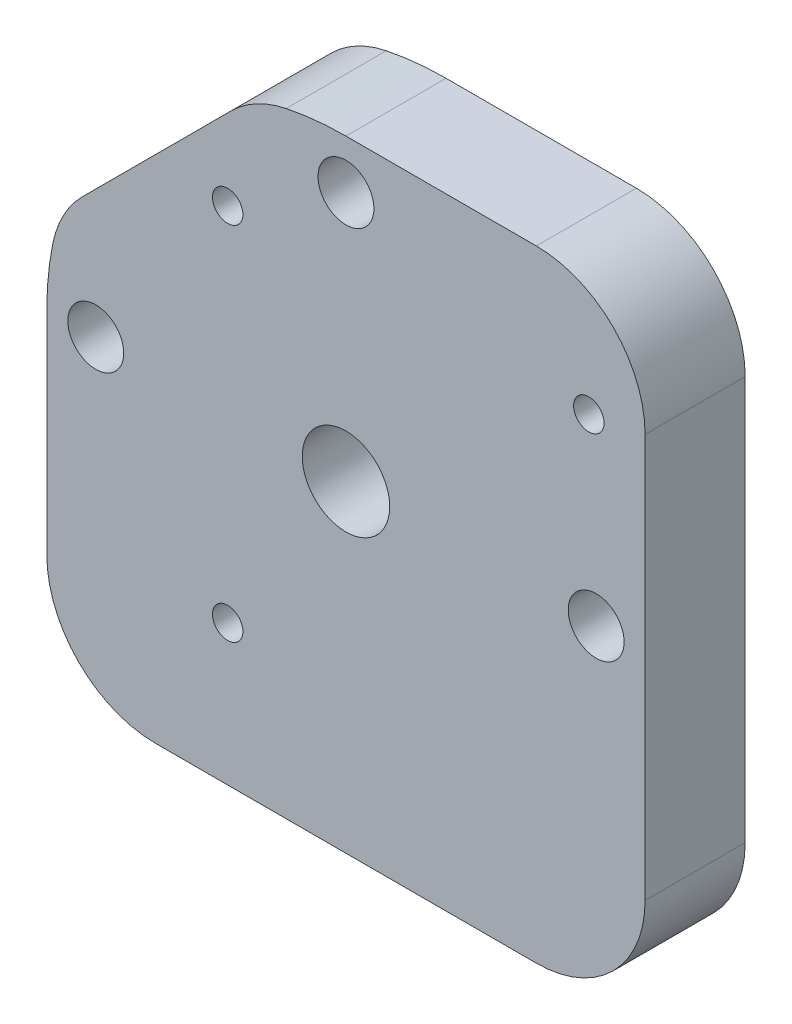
SolidWorks part; units mm, degrees
ref_plane "Front Plane" through (0, 0, 0) normal (0, 0, 1) x (1, 0, 0)
ref_plane "Top Plane" through (0, 0, 0) normal (0, 1, 0) x (1, 0, 0)
ref_plane "Right Plane" through (0, 0, 0) normal (1, 0, 0) x (0, 0, -1)
sketch "Sketch1" plane through (0, 0, 0) normal (0, 0, 1) x (1, 0, 0)
  circle A0 centre (0, 0) radius 17.4625
  dimension "D1" = 34.925
extrude "Boss-Extrude1" add sketch "Sketch1" along normal blind 5.842
sketch "Sketch6" plane through (0, 0, 5.842) normal (0, 0, 1) x (1, 0, 0)
  line L0 (-17.4625, 0) -> (0, 0)
  line L2 (-17.4625, 0) -> (-17.4625, -18.796)
  line L3 (-17.4625, -18.796) -> (17.4625, -18.796)
  line L4 (17.4625, 0) -> (17.4625, -18.796)
  line L5 (0, 0) -> (0, 17.4625)
  line L6 (0, 17.4625) -> (17.4625, 17.4625)
  line L7 (17.4625, 17.4625) -> (17.4625, 0)
  circle A0 centre (0, 0) radius 17.4625 construction
extrude "Boss-Extrude2" add sketch "Sketch6" against normal up to surface (5.842 mm away)
fillet "Fillet1" radius 6.35 3 edges at (17.4625, -18.796, 2.921) (-17.4625, -18.796, 2.921) (17.4625, 17.4625, 2.921)
hole_wizard "#4 Clearance Hole1" positions "Sketch2" profile "Sketch3" hole size "#4" standard "ANSI Inch"
sketch "Sketch2" plane through (0, 0, 5.842) normal (0, 0, 1) x (1, 0, 0)
  circle A0 centre (0, 0) radius 14.605
  point P5 (14.605, 0)
  point P7 (0, 14.605)
  point P9 (-14.605, 0)
  dimension "D1" = 29.21
sketch "Sketch3" plane through (-14.605, 0, 5.842) normal (1, 0, 0) x (0, -1, 0)
  line L0 (0, 0) -> (0, 5.842)
  line L1 (0, 5.842) -> (1.6319, 5.842)
  line L2 (1.6319, 5.842) -> (1.6319, 0)
  line L5 (1.6319, 0) -> (0, 0)
  line L11 (0, -6.35) -> (0, 107.95) construction
  dimension "Thru Hole Dia." = 3.2639
  dimension "Thru Hole Depth" = 5.842
hole_wizard "#2-56 Tapped Hole1" positions "Sketch7" profile "Sketch8" tap size "#2-56" standard "ANSI Inch"
sketch "Sketch7" plane through (0, 0, 5.842) normal (0, 0, 1) x (1, 0, 0)
  point P0 (-6.9052, 10.4822)
  point P3 (-6.9052, -10.5998)
  point P5 (14.1768, 10.4822)
sketch "Sketch8" plane through (-6.9052, 10.4822, 5.842) normal (1, 0, 0) x (0, -1, 0)
  line L0 (0, 0) -> (0, 5.842)
  line L1 (0, 5.842) -> (0.889, 5.842)
  line L2 (0.889, 5.842) -> (0.889, 0)
  line L5 (0.889, 0) -> (0, 0)
  line L11 (0, -6.35) -> (0, 107.95) construction
  dimension "Thru Tap Drill Dia." = 1.778
  dimension "Thru Tap Drill Depth" = 5.842
sketch "Sketch9" plane through (0, 0, 5.842) normal (0, 0, 1) x (1, 0, 0)
  line L0 (-19.7735, 2.315) -> (-1.6108, 20.4777)
  line L1 (-19.7735, 2.315) -> (-19.7735, 20.4777)
  line L2 (-19.7735, 20.4777) -> (-1.6108, 20.4777)
  dimension "D1" = 45
extrude "Cut-Extrude2" cut sketch "Sketch9" against normal blind 50.8
fillet "Fillet2" radius 6.35 2 edges at (-5.522, 16.5664, 2.921) (-16.5664, 5.522, 2.921)
hole_wizard "1/4-20 Tapped Hole1" positions "Sketch12" profile "Sketch13" tap size "1/4-20" standard "ANSI Inch"
sketch "Sketch12" plane through (0, 0, 5.842) normal (0, 0, 1) x (1, 0, 0)
  point P0 (0, 0)
sketch "Sketch13" plane through (0, 0, 5.842) normal (1, 0, 0) x (0, -1, 0)
  line L0 (0, 0) -> (0, 5.842)
  line L1 (0, 5.842) -> (2.5527, 5.842)
  line L2 (2.5527, 5.842) -> (2.5527, 0)
  line L5 (2.5527, 0) -> (0, 0)
  line L11 (0, -6.35) -> (0, 107.95) construction
  dimension "Thru Tap Drill Dia." = 5.1054
  dimension "Thru Tap Drill Depth" = 5.842
